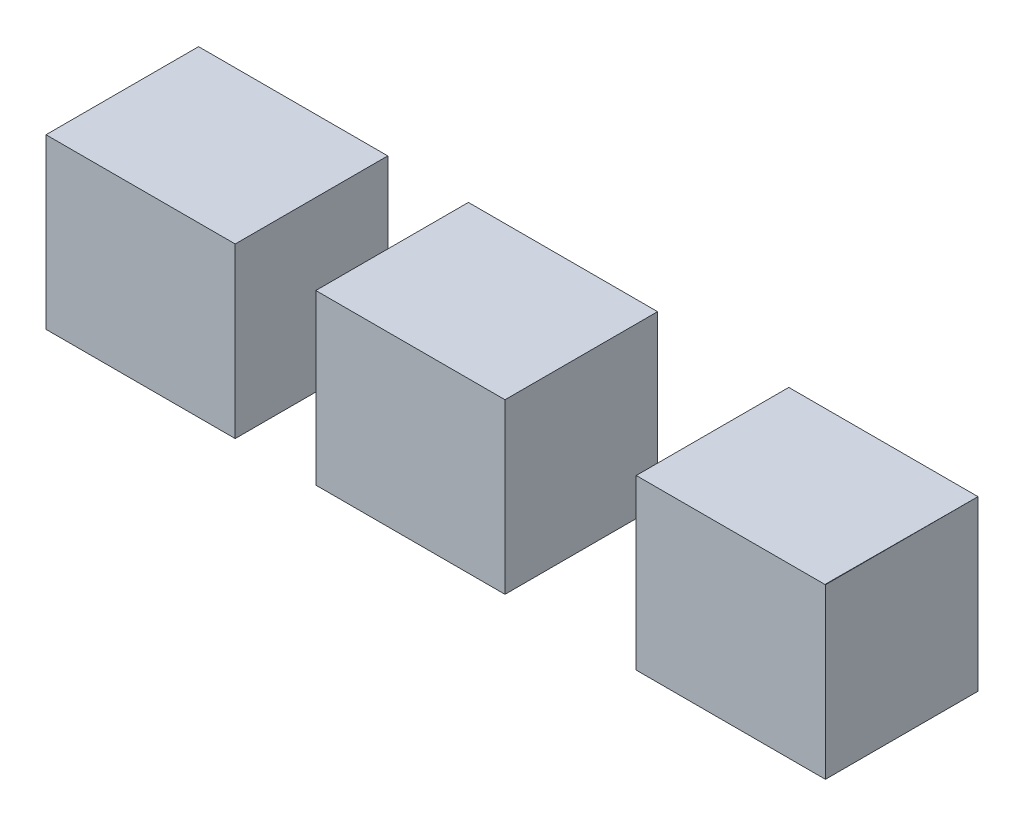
SolidWorks part; units mm, degrees
other "Objet de détail1"
other "Objet de détail2"
other "Objet de détail3"
ref_plane "Plan de face" through (0, 0, 0) normal (0, 0, 1) x (1, 0, 0)
ref_plane "Plan de dessus" through (0, 0, 0) normal (0, 1, 0) x (1, 0, 0)
ref_plane "Plan de droite" through (0, 0, 0) normal (1, 0, 0) x (0, 0, -1)
sketch "Esquisse1" plane through (0, 0, 0) normal (0, 0, 1) x (1, 0, 0)
  line L1 (-62.0012, -55.2361) -> (62.0012, -55.2361)
  line L2 (-62.0012, -55.2361) -> (-62.0012, 55.2361)
  line L3 (-62.0012, 55.2361) -> (62.0012, 55.2361)
  line L4 (62.0012, -55.2361) -> (62.0012, 55.2361)
  line L5 (-62.0012, -55.2361) -> (62.0012, 55.2361) construction
  line L6 (-62.0012, 55.2361) -> (62.0012, -55.2361) construction
  point P0 (0, 0)
extrude "Boss.-Extru.1" add sketch "Esquisse1" along normal blind 100
surface "Surface-Décalage1" parameters "D1"=0
other "SupprimerFace1"
move or copy body "Corps-Déplacer/Copier1" bodies to move or copy 102 103 copy yes number of copies 1 translate (210, 0, 0)
sketch "Esquisse2" plane through (0, 55.2361, 0) normal (0, 1, 0) x (1, 0, 0)
  line L0 (272.0012, 0) -> (271.6813, -100)
  line L1 (272.0012, -100) -> (147.9988, -100) construction
surface "Surface-Restreindre1"
move or copy body "Corps-Déplacer/Copier2" bodies to move or copy 102 103 copy yes number of copies 1 translate (-176.8308, 0, 0)
surface "Surface-Cousue2"
move or copy body "Corps-Déplacer/Copier3" [suppressed] bodies to move or copy 102 106 copy no translate (0, 77.2344, 0)
sketch "Esquisse3" plane through (0, 0, 0) normal (0, 1, 0) x (1, 0, 0)
  text T0 "Regardez les configurations pour voir la composition des cubes" font "Century Gothic" height 10
